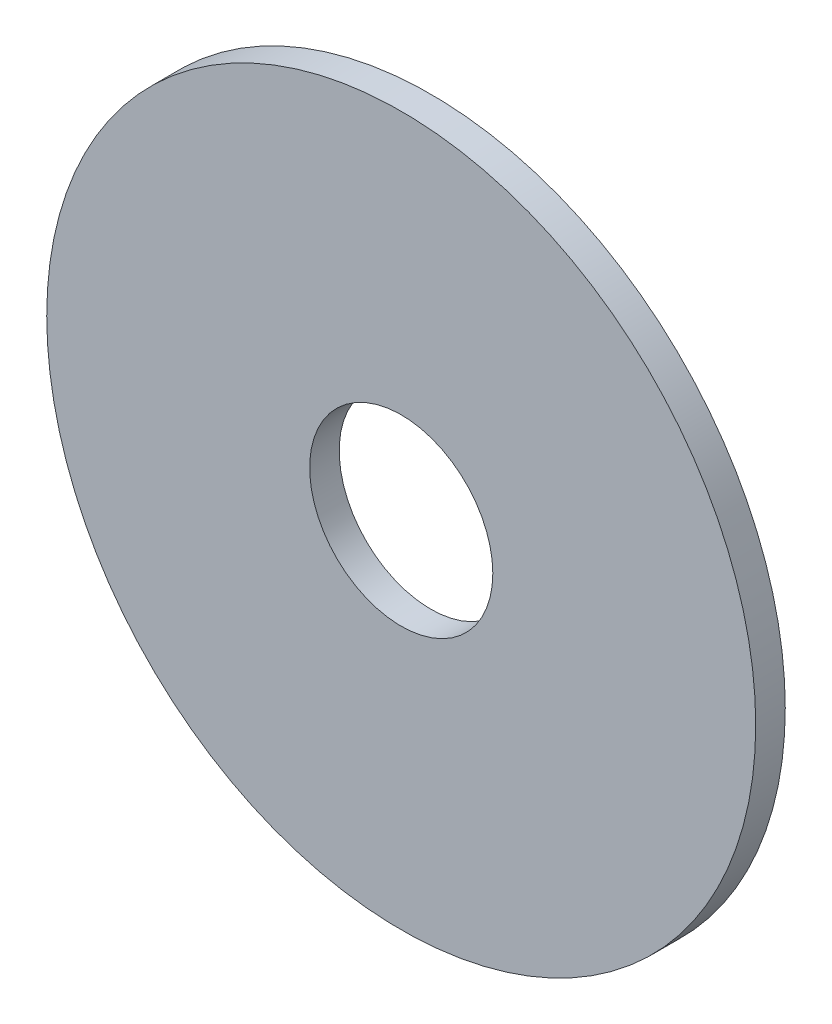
SolidWorks part; units mm, degrees
ref_plane "Plan de face" through (0, 0, 0) normal (0, 0, 1) x (1, 0, 0)
ref_plane "Plan de dessus" through (0, 0, 0) normal (0, 1, 0) x (1, 0, 0)
ref_plane "Plan de droite" through (0, 0, 0) normal (1, 0, 0) x (0, 0, -1)
sketch "Esquisse1" plane through (0, 0, 0) normal (0, 0, 1) x (1, 0, 0)
  circle A0 centre (0, 0) radius 1.55
  circle A1 centre (0, 0) radius 6
  dimension "D1" = 3.1
  dimension "D2" = 12
extrude "Boss.-Extru.1" add sketch "Esquisse1" along normal blind 0.5
